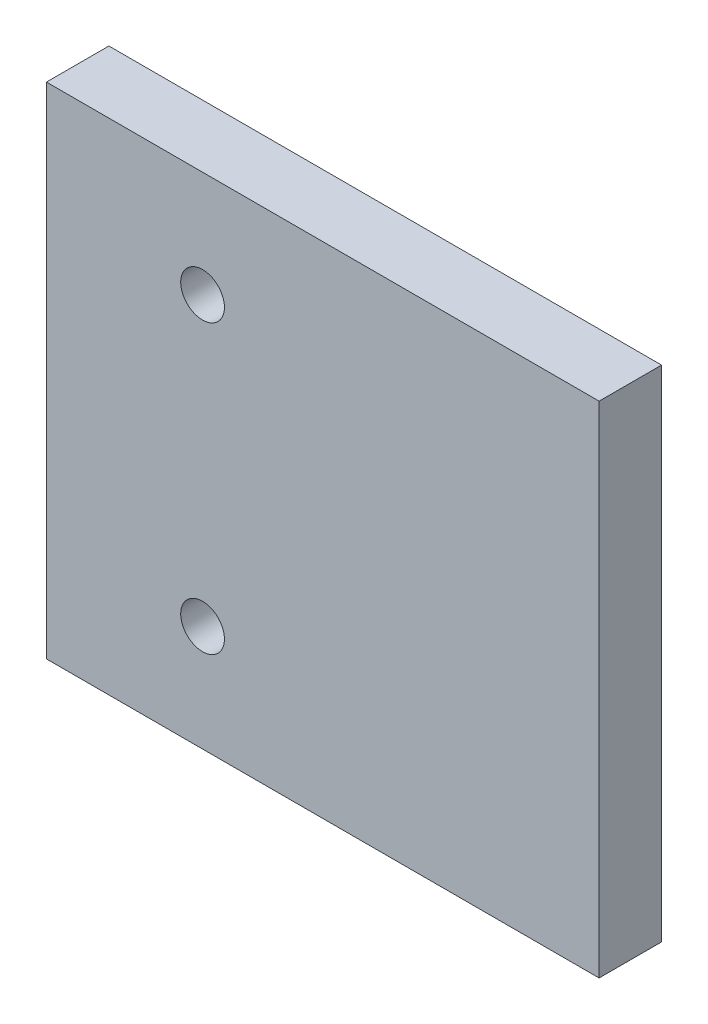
SolidWorks part; units mm, degrees
ref_plane "Plan de face" through (0, 0, 0) normal (0, 0, 1) x (1, 0, 0)
ref_plane "Plan de dessus" through (0, 0, 0) normal (0, 1, 0) x (1, 0, 0)
ref_plane "Plan de droite" through (0, 0, 0) normal (1, 0, 0) x (0, 0, -1)
sketch "Esquisse1" plane through (0, 0, 0) normal (0, 0, 1) x (1, 0, 0)
  line L1 (0, 0) -> (88.5, 0)
  line L2 (0, 0) -> (0, 80)
  line L3 (0, 80) -> (88.5, 80)
  line L4 (88.5, 0) -> (88.5, 80)
  circle A0 centre (25, 63) radius 3.5
  circle A1 centre (25, 17) radius 3.5
  dimension "D5" = 7
  dimension "D6" = 7
  dimension "D2" = 46
  dimension "D3" = 17
  dimension "D1" = 88.5
  dimension "D4" = 25
  dimension "D7" = 25
  dimension "D8" = 80
extrude "Extrusion1" add sketch "Esquisse1" along normal blind 10
